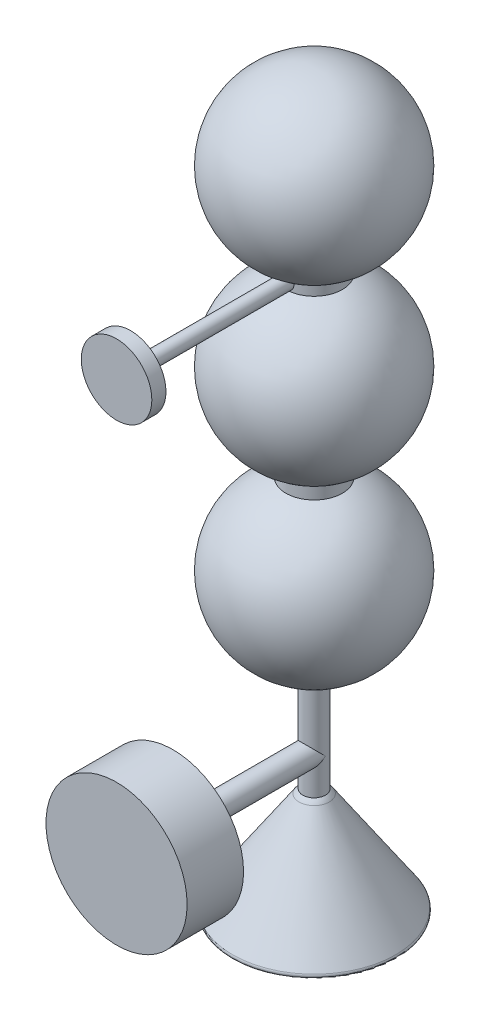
SolidWorks part; units mm, degrees
ref_plane "Alzado" through (0, 0, 0) normal (0, 0, 1) x (1, 0, 0)
ref_plane "Planta" through (0, 0, 0) normal (0, 1, 0) x (1, 0, 0)
ref_plane "Vista lateral" through (0, 0, 0) normal (1, 0, 0) x (0, 0, -1)
sketch "Croquis2" plane through (0, 0, 0) normal (0, 1, 0) x (1, 0, 0)
  circle A0 centre (0, 0) radius 8
  dimension "D1" = 16
extrude "Saliente-Extruir2" add sketch "Croquis2" along normal blind 150 separate body
sketch "Croquis3" plane through (0, 0, 0) normal (0, 0, 1) x (1, 0, 0)
  line L0 (0, 1237.2468) -> (0, 0) construction
  line L2 (0, 150) -> (0, 270)
  line L3 (8, 150) -> (-8, 150) construction
  arc A0 (0, 150) -> (0, 270) centre (0, 210) cw
  dimension "D1" = 60
revolve "Revolución1" add sketch "Croquis3" angle 360 about L0
sketch "Croquis6" plane through (0, 0, 0) normal (0, 0, 1) x (1, 0, 0)
  line L0 (0, 253.6138) -> (0, 277.2982) construction
  line L1 (0, 267.2982) -> (0, 277.2982)
  line L2 (0, 267.2982) -> (-20, 267.2982)
  line L4 (0, 277.2982) -> (-20, 277.2982)
  line L5 (-20, 267.2982) -> (-20, 277.2982)
  dimension "D1" = 10
  dimension "D2" = 20
revolve "Revolución3" add sketch "Croquis6" angle 360 about L0
pattern_linear "MatrizL1" count 2 spacing 125 along (0, 1, 0)
sketch "Croquis7" plane through (0, 0, 0) normal (0, 0, 1) x (1, 0, 0)
  line L0 (0, 398.2903) -> (0, 518.2903) construction
  line L2 (0, 398.2903) -> (0, 518.2903)
  arc A0 (0, 398.2903) -> (0, 518.2903) centre (0, 458.2903) cw
  dimension "D1" = 120
revolve "Revolución4" add sketch "Croquis7" angle 360 about L0
sketch "Croquis8" plane through (0, 0, 0) normal (0, 0, 1) x (1, 0, 0)
  line L0 (0, 0) -> (0, 100) construction
  circle A0 centre (0, 100) radius 8
  dimension "D2" = 16
  dimension "D1" = 100
extrude "Saliente-Extruir3" add sketch "Croquis8" along normal blind 100
sketch "Croquis9" plane through (0, 0, 100) normal (0, 0, 1) x (1, 0, 0)
  circle A0 centre (0, 100) radius 50
  dimension "D1" = 100
extrude "Saliente-Extruir4" add sketch "Croquis9" along normal blind 40 separate body
sketch "Croquis10" plane through (0, 0, 0) normal (0, 0, 1) x (1, 0, 0)
  circle A0 centre (0, 397.1167) radius 5
  dimension "D2" = 10
extrude "Saliente-Extruir5" add sketch "Croquis10" along normal blind 130
sketch "Croquis11" plane through (0, 0, 130) normal (0, 0, 1) x (1, 0, 0)
  circle A0 centre (0, 397.1167) radius 25
  dimension "D1" = 50
extrude "Saliente-Extruir6" add sketch "Croquis11" along normal blind 10 separate body
sketch "Croquis5" plane through (0, 0, 0) normal (0, 0, 1) x (1, 0, 0)
  line L0 (0, 0) -> (0, 80) construction
  line L1 (0, 0) -> (-60, 0)
  line L2 (-60, 0) -> (-10.6517, 73.1619)
  line L3 (0, 0) -> (0, 80)
  arc A1 (-10.6517, 73.1619) -> (0, 80) centre (2.6129, 64.2148) cw
  circle A2 centre (0, 585) radius 60 construction
  point P2 (60, 585)
  dimension "D2" = 80
  dimension "D3" = 16
  dimension "D1" = 60
  dimension "D4" = 56
revolve "Revolución2" add sketch "Croquis5" angle 360 about L0
fillet "Redondeo2" radius 2 1 edges at (0, 0, -60)
ref_plane "Plano1" through (0, -500, 0) normal (0, -1, 0) x (-1, 0, 0)
